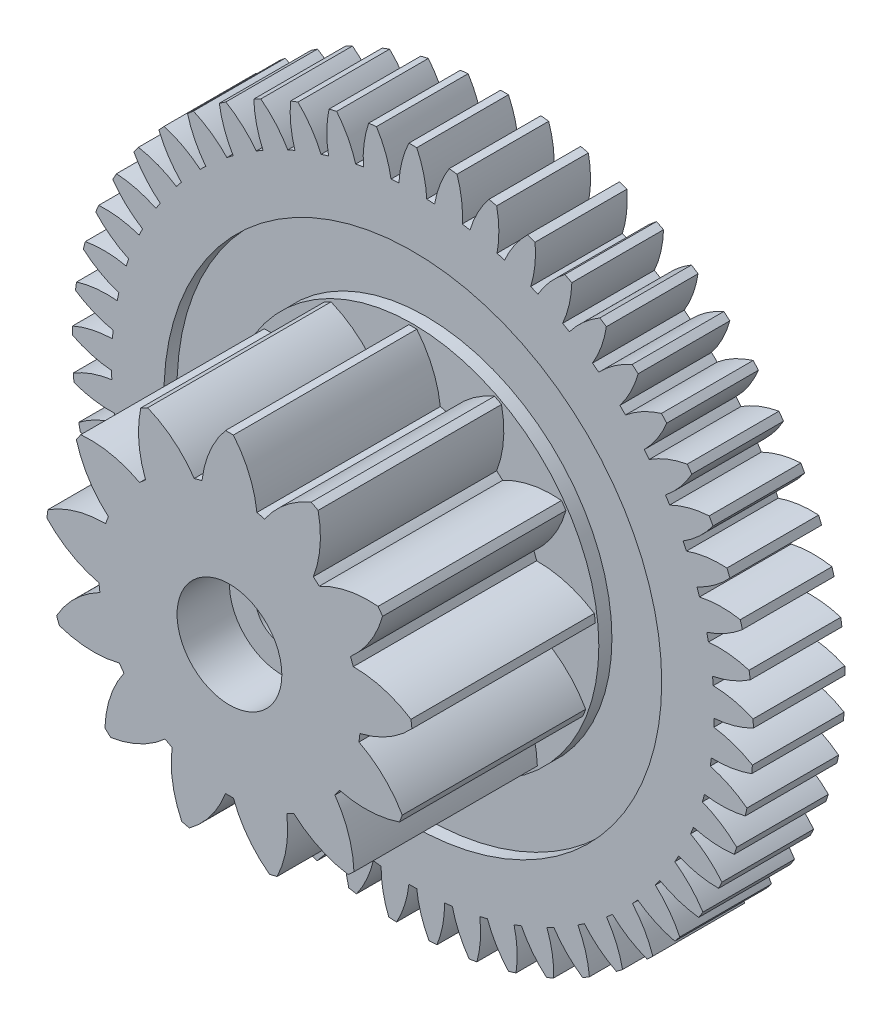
SolidWorks part; units mm, degrees
ref_plane "Plan1" through (0, 0, 0) normal (0, 0, 1) x (1, 0, 0)
ref_plane "Plan2" through (0, 0, 0) normal (0, 1, 0) x (1, 0, 0)
ref_plane "Plan3" through (0, 0, 0) normal (1, 0, 0) x (0, 0, -1)
sketch "Esquisse1" plane through (0, 0, 0) normal (0, 0, 1) x (1, 0, 0)
  circle A0 centre (0, 0) radius 13
  dimension "D1" = 26
extrude "Base-Extrusion" add sketch "Esquisse1" along normal blind 3.5
sketch "Esquisse2" plane through (0, 0, 3.5) normal (0, 0, 1) x (1, 0, 0)
  circle A0 centre (0, 0) radius 7
  dimension "D1" = 14
extrude "Boss.-Extru.1" add sketch "Esquisse2" along normal blind 7
sketch "Esquisse3" plane through (0, 0, 10.5) normal (0, 0, 1) x (1, 0, 0)
  line L0 (0, 0) -> (0, 7) construction
  line L1 (0, 0) -> (1.5136, 6.1408) construction
  line L2 (0, 0) -> (3.2861, 6.2611) construction
  line L3 (1.1966, 4.8547) -> (1.8998, 7.7078)
  line L4 (-1.1966, 4.8547) -> (-1.8998, 7.7078)
  line L5 (1.8998, 7.7078) -> (-1.8998, 7.7078)
  circle A0 centre (0, 0) radius 5 construction
  circle A1 centre (0, 0) radius 7 construction
  arc A2 (0.15, 6.9984) -> (1.0488, 4.8888) centre (-2.9261, 4.4415) cw
  circle A3 centre (0, 0) radius 7 construction
  arc A4 (-1.0488, 4.8888) -> (-1.1966, 4.8547) centre (0, 0) ccw
  arc A5 (-0.15, 6.9984) -> (0.15, 6.9984) centre (0, 0) cw
  arc A6 (1.0488, 4.8888) -> (1.1966, 4.8547) centre (0, 0) cw
  arc A7 (-0.15, 6.9984) -> (-1.0488, 4.8888) centre (2.9261, 4.4415) ccw
  dimension "D1" = 14
  dimension "D2" = 10
  dimension "D7" = 4
  dimension "D3" = 13.846
  dimension "D4" = 27.692
  dimension "D5" = 0.15
  dimension "D6" = 0.1516
extrude "Enlèv. mat.-Extru.1" cut sketch "Esquisse3" against normal up to surface (7 mm away)
pattern_circular "Répétition circulaire1" count 13 every 27.692 about axis through (0, 0, 0) along (0, 0, 1) of "Enlèv. mat.-Extru.1"
sketch "Esquisse4" plane through (0, 0, 3.5) normal (0, 0, 1) x (1, 0, 0)
  line L0 (0, 0) -> (0, 13.9994) construction
  line L1 (0, 0) -> (0.8482, 14.2921) construction
  line L2 (0, 0) -> (1.7462, 14.6606) construction
  line L3 (0.6813, 11.4798) -> (0.8886, 14.9731)
  line L4 (-0.6813, 11.4798) -> (-0.8886, 14.9731)
  line L5 (0.8886, 14.9731) -> (-0.8886, 14.9731)
  circle A0 centre (0, 0) radius 13 construction
  circle A1 centre (0, 0) radius 11.5 construction
  arc A2 (-0.5315, 11.4877) -> (-0.6813, 11.4798) centre (0, 0) ccw
  arc A3 (-0.15, 12.9991) -> (0.15, 12.9991) centre (0, 0) cw
  arc A4 (0.15, 12.9991) -> (0.5315, 11.4877) centre (-3.4633, 11.2833) cw
  arc A7 (-0.15, 12.9991) -> (-0.5315, 11.4877) centre (3.4633, 11.2833) ccw
  arc A8 (0.5315, 11.4877) -> (0.6813, 11.4798) centre (0, 0) cw
  dimension "D1" = 23
  dimension "D2" = 26
  dimension "D7" = 4
  dimension "D3" = 3.396
  dimension "D4" = 6.792
  dimension "D5" = 0.15
  dimension "D6" = 0.15
extrude "Enlèv. mat.-Extru.2" cut sketch "Esquisse4" against normal through all
pattern_circular "Répétition circulaire2" count 53 every 6.792 about axis through (0, 0, 0) along (0, 0, 1) of "Enlèv. mat.-Extru.2"
sketch "Esquisse5" plane through (0, 0, 10.5) normal (0, 0, 1) x (1, 0, 0)
  circle A0 centre (0, 0) radius 1
  dimension "D1" = 2
extrude "Enlèv. mat.-Extru.3" cut sketch "Esquisse5" against normal through all
sketch "Esquisse6" plane through (0, 0, 0) normal (0, 0, -1) x (-1, 0, 0)
  circle A0 centre (0, 0) radius 1
  circle A1 centre (0, 0) radius 1 construction
  circle A2 centre (0, 0) radius 2.25
  dimension "D1" = 4.5
extrude "Extrusion1" add sketch "Esquisse6" along normal blind 0.5
sketch "Esquisse7" plane through (0, 0, 3.5) normal (0, 0, 1) x (1, 0, 0)
  circle A0 centre (0, 0) radius 7.1
  circle A1 centre (0, 0) radius 9.5
  dimension "D1" = 14.2
  dimension "D2" = 19
extrude "Enlèv. mat.-Extru.4" cut sketch "Esquisse7" against normal blind 0.5
sketch "Esquisse9" plane through (0, 0, 10.5) normal (0, 0, 1) x (1, 0, 0)
  circle A0 centre (0, 0) radius 2
  dimension "D1" = 4
extrude "Enlèv. mat.-Extru.5" cut sketch "Esquisse9" against normal blind 2
